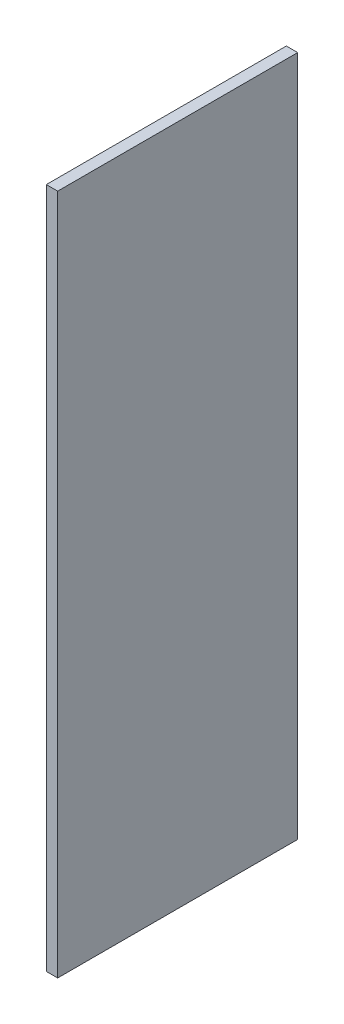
SolidWorks part; units mm, degrees
ref_plane "Plan de face" through (0, 0, 0) normal (0, 0, 1) x (1, 0, 0)
ref_plane "Plan de dessus" through (0, 0, 0) normal (0, 1, 0) x (1, 0, 0)
ref_plane "Plan de droite" through (0, 0, 0) normal (1, 0, 0) x (0, 0, -1)
sketch "Esquisse1" plane through (0, 0, 0) normal (1, 0, 0) x (0, 0, -1)
  line L1 (-31.7, 90) -> (31.7, 90)
  line L2 (-31.7, 90) -> (-31.7, -90)
  line L3 (-31.7, -90) -> (31.7, -90)
  line L4 (31.7, 90) -> (31.7, -90)
  line L5 (-31.7, 90) -> (31.7, -90) construction
  line L6 (-31.7, -90) -> (31.7, 90) construction
  point P0 (0, 0)
  dimension "D1" = 63.4
  dimension "D2" = 180
extrude "Boss.-Extru.1" add sketch "Esquisse1" along normal mid plane 3
